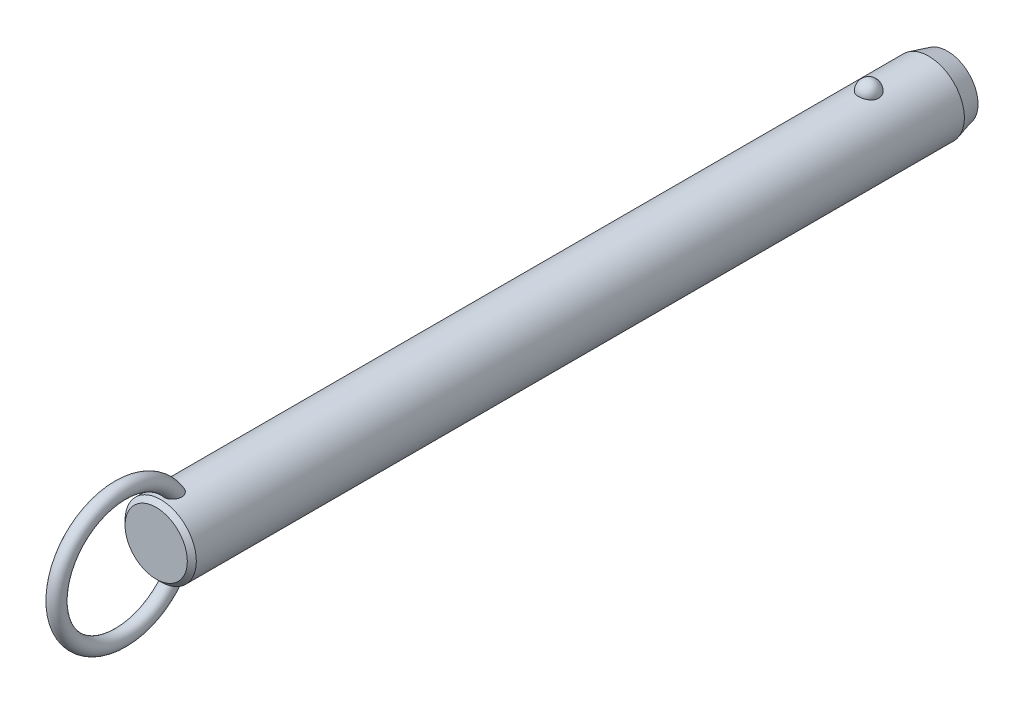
SolidWorks part; units mm, degrees
ref_plane "Front Plane" through (0, 0, 0) normal (0, 0, 1) x (1, 0, 0)
ref_plane "Top Plane" through (0, 0, 0) normal (0, 1, 0) x (1, 0, 0)
ref_plane "Right Plane" through (0, 0, 0) normal (1, 0, 0) x (0, 0, -1)
sketch "Sketch2" plane through (0, 0, 0) normal (0, 0, 1) x (1, 0, 0)
  circle A0 centre (0, 0) radius 9.5
  point P3 (0, 9.5)
  dimension "D1" = 19
extrude "Boss-Extrude1" add sketch "Sketch2" along normal blind 177.8
sketch "Sketch3" plane through (0, 0, 0) normal (0, 0, -1) x (-1, 0, 0)
  circle A0 centre (0, 0) radius 9.5
  dimension "D1" = 19
extrude "Boss-Extrude2" add sketch "Sketch3" along normal blind 23.7
chamfer "Chamfer1" distance 5 angle 15 1 edges at (-9.5, 0, -23.7)
sketch "Sketch12" plane through (0, 0, 0) normal (1, 0, 0) x (0, 0, -1)
  line L0 (-177.8, 9.5) -> (-177.8, -9.5) construction
  point P0 (-177.8, 0)
sketch "Sketch13" plane through (0, 0, 0) normal (1, 0, 0) x (0, 0, -1)
  circle A0 centre (-196.85, 0) radius 19.05
  point P2 (-177.8, 0)
  dimension "D1" = 38.1
sketch "Sketch14" plane through (0, 0, 0) normal (0, 1, 0) x (1, 0, 0)
  circle A0 centre (0, -179.8) radius 2
  point P2 (0, -177.8)
  dimension "D1" = 4
sweep "Sweep1" add profiles "Sketch14" path "Sketch13"
sketch "Sketch15" plane through (0, 0, 177.8) normal (0, 0, 1) x (1, 0, 0)
  circle A0 centre (0, 0) radius 9.5
  dimension "D1" = 19
extrude "Boss-Extrude3" add sketch "Sketch15" along normal blind 9.52
chamfer "Chamfer2" distance 1.2 angle 45 1 edges at (9.5, 0, 187.32)
sketch "Sketch18" plane through (0, 0, 0) normal (1, 0, 0) x (0, 0, -1)
  line L0 (18.7, 9.5) -> (-180.3378, 9.5) construction
  line L1 (2.7, 12.2) -> (2.7, 6.8)
  line L2 (-180.3378, -9.5) -> (18.7, -9.5) construction
  arc A0 (2.7, 12.2) -> (2.7, 6.8) centre (2.7, 9.5) ccw
  point P4 (0, 9.5)
  dimension "D1" = 21.7
revolve "Revolve1" add sketch "Sketch18" angle 360 about L1
